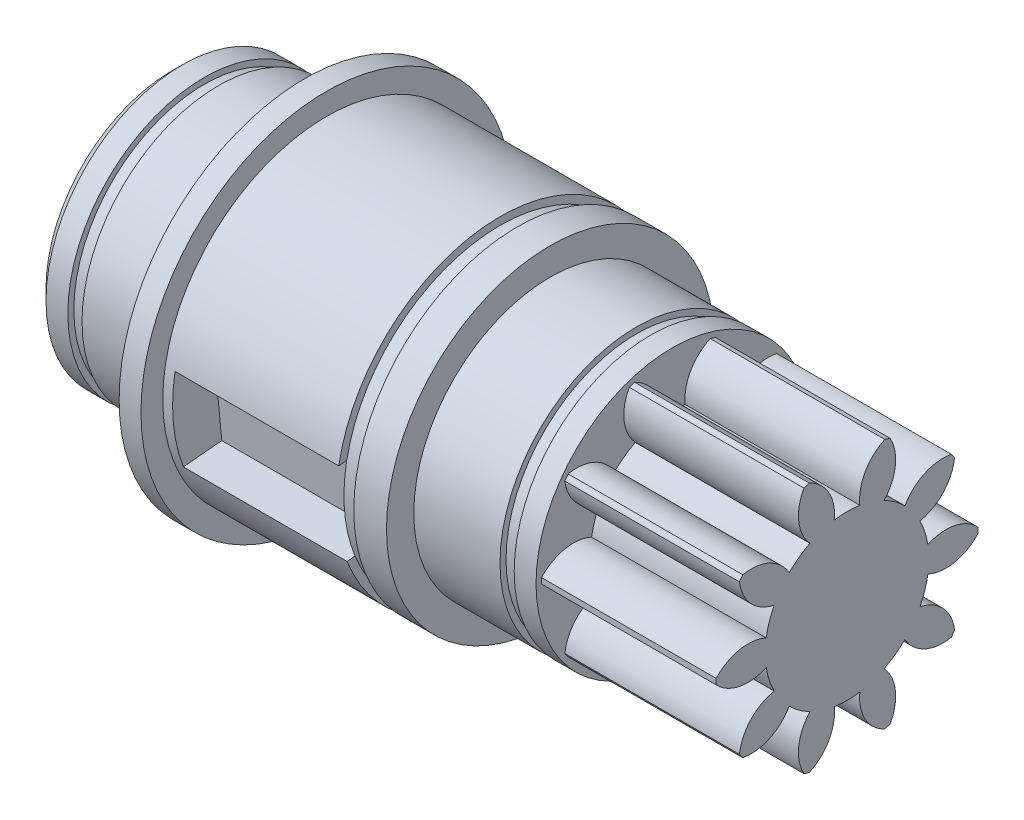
SolidWorks part; units mm, degrees
ref_plane "Plane1" through (0, 0, 0) normal (0, 0, 1) x (1, 0, 0)
ref_plane "Plane2" through (0, 0, 0) normal (0, 1, 0) x (1, 0, 0)
ref_plane "Plane3" through (0, 0, 0) normal (1, 0, 0) x (0, 0, -1)
sketch "HoldingSke" plane through (0, 0, 0) normal (0, 1, 0) x (1, 0, 0)
  line L0 (0, 0) -> (0.4924, -0.0868)
  line L1 (-15, 0) -> (100, 0) construction
  line L2 (0, 0) -> (-2.1039, 2.3779)
  line L3 (0, 0) -> (-11.863, 4.5341)
  line L4 (0, 0) -> (8.5048, 1.4996)
  line L5 (0, 0) -> (-46.8476, -17.4728)
  line L6 (0, 0) -> (-13.2634, -8.9489)
  line L7 (-2.1039, 2.3779) -> (8.6586, 51.2059)
  line L8 (-76.2, 54.61) -> (-73.9, 54.61)
  line L9 (-71.009, 38.7566) -> (-53.1078, 45.2721)
  line L10 (-76.2, 71.12) -> (104.1128, 71.12)
  line L11 (0, 0) -> (-16, 0)
  line L12 (-76.2, 101.6) -> (-76.133, 101.6)
  line L13 (24.9733, 27.94) -> (52.9518, 28.4284)
  line L14 (24.9733, 27.94) -> (24.9743, 27.94)
  line L15 (24.9733, 27.94) -> (100.4006, 29.5858)
  line L16 (-63.627, -2) -> (-12.827, -2)
  circle A0 centre (0, 0) radius 8
  circle A1 centre (0, 0) radius 7.499
  circle A2 centre (0, 0) radius 37.5
  circle A3 centre (0, 0) radius 7.4736
  dimension "MHD" = 14.998
  dimension "Hub_dia" = 75
  dimension "Bore" = 16
  dimension "MBD" = 14.9472
  dimension "Num_teeth" = 10
  dimension "Pitch_radius" = 180.3128
  dimension "Pitch" = 0.5
  dimension "Width" = 16
  dimension "Overall_len" = 50
  dimension "Show_teeth" = 10
  dimension "Thickness" = 16
  dimension "OAL" = 50.0001
  dimension "T_dim" = 2.3
  dimension "Ap" = 20
  dimension "H" = 19.05
  dimension "Backlash" = 0.067
  dimension "Addendum_fac" = 1
  dimension "Dedendum_fac" = 1.25
  dimension "Clearance_fac" = 0.25
  dimension "Dedendum_add" = 0.001
  dimension "Module" = 2
sketch "BasProSke" plane through (0, 0, 0) normal (0, 1, 0) x (1, 0, 0)
  line L0 (-10, 0) -> (60, 0) construction
  line L1 (0, 0) -> (0, 12)
  line L2 (0, 0) -> (16, 0)
  line L3 (16, 0) -> (16, 12)
  line L4 (16, 12) -> (0, 12)
  dimension "Diameter" = 24
  dimension "Thickness" = 16
revolve "Base-Revolve" add sketch "BasProSke" angle 360 about L0
sketch "TooCutSke" plane through (0, 0, 0) normal (1, 0, 0) x (0, 0, -1)
  line L1 (0, 0) -> (0, 107) construction
  line L2 (0, 0) -> (-1.6814, 9.8576) construction
  line L3 (0, 0) -> (-6.1153, 18.8209) construction
  line L4 (-1.6814, 9.8576) -> (-3.0576, 9.4105) construction
  arc A0 (1.1737, 7.4066) -> (-1.1737, 7.4066) centre (0, 0) ccw
  arc A1 (3.4979, 11.5054) -> (-3.4979, 11.5054) centre (0, 0) ccw
  circle A2 centre (0, 0) radius 10 construction
  circle A3 centre (0, 0) radius 9.3969 construction
  arc A4 (-1.1737, 7.4066) -> (-3.4979, 11.5054) centre (-5.1477, 7.8615) ccw
  arc A5 (3.4979, 11.5054) -> (1.1737, 7.4066) centre (5.1477, 7.8615) ccw
  dimension "Root_dia" = 14.998
  dimension "Overcut_dia" = 24.0508
  dimension "Pitch_dia" = 20
  dimension "Base_dia" = 18.7939
  dimension "Flank_rad" = 4
  dimension "Half_ang" = 18
  dimension "Half_CT" = 1.4471
extrude "ToothCut" cut sketch "TooCutSke" along normal through all
fillet "Breaks" [suppressed] radius 0.04
fillet "RootFillets" [suppressed] radius 0.501
pattern_circular "TeethCuts" count 10 every 36 about axis through (-10, 0, 0) along (1, 0, 0) of "ToothCut", "RootFillets", "Breaks"
sketch "HubNeaOneSke" plane through (0, 0, 0) normal (-1, 0, 0) x (0, 0, 1)
  circle A0 centre (0, 0) radius 7.499
  dimension "Diameter" = 14.998
extrude "HubNearOne" [suppressed] add sketch "HubNeaOneSke" along normal blind 34.0001
sketch "HubNeaBotSke" plane through (0, 0, 0) normal (-1, 0, 0) x (0, 0, 1)
  circle A0 centre (0, 0) radius 7.499
  dimension "Diameter" = 14.998
extrude "HubNearBoth" [suppressed] add sketch "HubNeaBotSke" along normal blind 17
ref_plane "FarPln" through (16, 0, 0) normal (1, 0, 0) x (0, 0, -1)
sketch "HubFarSke" plane through (16, 0, 0) normal (1, 0, 0) x (0, 0, -1)
  circle A0 centre (0, 0) radius 7.499
  dimension "Diameter" = 14.998
extrude "HubFar" [suppressed] add sketch "HubFarSke" along normal blind 17
sketch "BorSke" plane through (0, 0, 0) normal (1, 0, 0) x (0, 0, -1)
  circle A0 centre (0, 0) radius 7.4736
  dimension "Diameter" = 14.9472
extrude "Bore" cut sketch "BorSke" along normal mid plane 100.0001
sketch "KeySke" plane through (0, 0, 0) normal (1, 0, 0) x (0, 0, -1)
  line L0 (-2.5, 0) -> (-2.5, 9.7736)
  line L1 (-2.5, 9.7736) -> (2.5, 9.7736)
  line L2 (2.5, 9.7736) -> (2.5, 0)
  line L3 (0, 0) -> (0, 34) construction
  line L4 (-2.5, 0) -> (2.5, 0)
  dimension "Offset" = 9.7736
  dimension "Width" = 5
extrude "Keyway" [suppressed] cut sketch "KeySke" along normal mid plane 100.0001
pattern_circular "Keyway2" [suppressed] count 2 every 90 about axis through (-10, 0, 0) along (1, 0, 0)
sketch "Esquisse1" plane through (16, 0, 0) normal (1, 0, 0) x (0, 0, -1)
  circle A0 centre (0, 0) radius 7.499
  arc A1 (3.404, -6.6819) -> (5.303, -5.3022) centre (0, 0) ccw construction
extrude "Extrusion2" add sketch "Esquisse1" against normal blind 16
sketch "Esquisse2" plane through (0, 0, 0) normal (-1, 0, 0) x (0, 0, 1)
  circle A0 centre (0, 0) radius 12.5
  dimension "D1" = 25
extrude "Extrusion3" add sketch "Esquisse2" along normal blind 2
sketch "Esquisse3" plane through (-2, 0, 0) normal (-1, 0, 0) x (0, 0, 1)
  circle A0 centre (0, 0) radius 11.95
  dimension "D1" = 23.9
extrude "Extrusion4" add sketch "Esquisse3" along normal blind 1.3
sketch "Esquisse4" plane through (-3.3, 0, 0) normal (-1, 0, 0) x (0, 0, 1)
  circle A0 centre (0, 0) radius 12.5
  dimension "D1" = 25
extrude "Extrusion5" add sketch "Esquisse4" along normal blind 7.9
sketch "Esquisse5" plane through (-11.2, 0, 0) normal (-1, 0, 0) x (0, 0, 1)
  circle A0 centre (0, 0) radius 15
  dimension "D1" = 30
extrude "Extrusion6" add sketch "Esquisse5" along normal blind 3
sketch "Esquisse6" plane through (-14.2, 0, 0) normal (-1, 0, 0) x (0, 0, 1)
  circle A0 centre (0, 0) radius 14.3
  dimension "D1" = 28.6
extrude "Extrusion7" add sketch "Esquisse6" along normal blind 1.6
sketch "Esquisse7" plane through (-15.8, 0, 0) normal (-1, 0, 0) x (0, 0, 1)
  circle A0 centre (0, 0) radius 15
  dimension "D1" = 30
extrude "Extrusion8" add sketch "Esquisse7" along normal blind 15.9
sketch "Esquisse8" plane through (-31.7, 0, 0) normal (-1, 0, 0) x (0, 0, 1)
  circle A0 centre (0, 0) radius 17
  dimension "D1" = 34
extrude "Extrusion9" add sketch "Esquisse8" along normal blind 2
sketch "Esquisse9" plane through (-33.7, 0, 0) normal (-1, 0, 0) x (0, 0, 1)
  circle A0 centre (0, 0) radius 12.5
  dimension "D1" = 25
extrude "Extrusion11" add sketch "Esquisse9" along normal blind 7.9
sketch "Esquisse10" plane through (-41.6, 0, 0) normal (-1, 0, 0) x (0, 0, 1)
  circle A0 centre (0, 0) radius 11.95
  dimension "D1" = 23.9
extrude "Extrusion12" add sketch "Esquisse10" along normal blind 1.3
sketch "Esquisse11" plane through (-42.9, 0, 0) normal (-1, 0, 0) x (0, 0, 1)
  circle A0 centre (0, 0) radius 12.5
  dimension "D1" = 25
extrude "Extrusion13" add sketch "Esquisse11" along normal blind 3
chamfer "Chanfrein1" distance 1 angle 45 1 edges at (-45.9, 0, 12.5)
sketch "Esquisse12" plane through (-15.8, 0, 0) normal (1, 0, 0) x (0, 0, -1)
  line L0 (-18.2565, 2.2687) -> (-17.4933, -5.6948)
  line L1 (-17.4933, -5.6948) -> (-10.4933, -5.0239)
  line L2 (-10.4933, -5.0239) -> (-11.2565, 2.9396)
  line L3 (-11.2565, 2.9396) -> (-18.2565, 2.2687)
  dimension "D1" = 7
extrude "Enlèv. mat.-Extru.1" cut sketch "Esquisse12" against normal blind 15
equation "' \"Module@HoldingSke\" = 6.35"
equation "' \"Num_teeth@HoldingSke\" = 12"
equation "' \"Ap@HoldingSke\" =  20"
equation "' \"Width@HoldingSke\" = 0.5 * 25.4"
equation "' \"Hub_dia@HoldingSke\"= 1 * 25.4"
equation "' \"Overall_len@HoldingSke\" = 1.0 * 25.4"
equation "' \"Bore@HoldingSke\" = 0.75 * 25.4"
equation "' \"T_dim@HoldingSke\" = 0.1 * 25.4"
equation "' \"Width@KeySke\" = 0.25 * 25.4"
equation "' \"Show_teeth@HoldingSke\" = 13"
equation "' \"Backlash@HoldingSke\" = 0.009 * 25.4"
equation "' \"Addendum_fac@HoldingSke\" = 1.0"
equation "' \"Dedendum_fac@HoldingSke\" = 1.25"
equation "' \"Dedendum_add@HoldingSke\" = 0.00005 * 25.4"
equation "' \"Clearance_fac@HoldingSke\" = 0.25"
equation "\"Pitch@HoldingSke\" = 1 / \"Module@HoldingSke\""
equation "\"Overcut_dia@TooCutSke\" = (\"Num_teeth@HoldingSke\" + 2 * \"Addendum_fac@HoldingSke\") / \"Pitch@HoldingSke\" + 0.002 * 25.4"
equation "\"Pitch_dia@TooCutSke\" = \"Num_teeth@HoldingSke\" / \"Pitch@HoldingSke\""
equation "\"Base_dia@TooCutSke\" = \"Num_teeth@HoldingSke\" / \"Pitch@HoldingSke\" * cos((\"Ap@HoldingSke\"  * 3.14159265 / 180))"
equation "\"Root_dia@TooCutSke\" = (\"Num_teeth@HoldingSke\" + 2) / \"Pitch@HoldingSke\" - 2 * (\"Addendum_fac@HoldingSke\" + \"Dedendum_fac@HoldingSke\") / \"Pitch@HoldingSke\" - \"Dedendum_add@HoldingSke\" * 2"
equation "\"Half_ang@TooCutSke\" = 180 / \"Num_teeth@HoldingSke\""
equation "\"Half_CT@TooCutSke\" = \"Num_teeth@HoldingSke\" / \"Pitch@HoldingSke\" * sin((3.14159265 / 2 / \"Num_teeth@HoldingSke\")) / 2 - 7 * \"Backlash@HoldingSke\" / 4"
equation "\"Flank_rad@TooCutSke\" = \"Num_teeth@HoldingSke\" / \"Pitch@HoldingSke\" / 5"
equation "\"Radius@RootFillets\" = \"Clearance_fac@HoldingSke\" / \"Pitch@HoldingSke\" + \"Dedendum_add@HoldingSke\""
equation "\"Break_rad@Breaks\" = 0.02 / \"Pitch@HoldingSke\""
equation "\"Thickness@HoldingSke\" = \"Width@HoldingSke\""
equation "\"OAL@HoldingSke\" = \"Thickness@HoldingSke\""
equation "\"MHD@HoldingSke\" = (\"Num_teeth@HoldingSke\" + 2) / \"Pitch@HoldingSke\" - 2 * (\"Addendum_fac@HoldingSke\" + \"Dedendum_fac@HoldingSke\")  / \"Pitch@HoldingSke\" - \"Dedendum_add@HoldingSke\" * 2"
equation "\"MBD@HoldingSke\" = (\"Num_teeth@HoldingSke\" + 2) / \"Pitch@HoldingSke\" - 2 * (\"Addendum_fac@HoldingSke\" + \"Dedendum_fac@HoldingSke\")  / \"Pitch@HoldingSke\" - \"Dedendum_add@HoldingSke\" * 2 - 0.002 * 25.4"
equation "\"MHD@HoldingSke\" = ((sgn( \"MHD@HoldingSke\" - \"Hub_dia@HoldingSke\" )-1)*( \"MHD@HoldingSke\" - \"Hub_dia@HoldingSke\" ))/-2+ \"Hub_dia@HoldingSke\""
equation "\"MBD@HoldingSke\" = ((sgn( \"MBD@HoldingSke\" - \"Bore@HoldingSke\" )-1)*( \"MBD@HoldingSke\" - \"Bore@HoldingSke\" ))/-2+ \"Bore@HoldingSke\""
equation "\"OAL@HoldingSke\" = ((sgn( \"OAL@HoldingSke\" - \"Overall_len@HoldingSke\" )+1)*( \"OAL@HoldingSke\" - \"Overall_len@HoldingSke\" ))/2 + \"Overall_len@HoldingSke\" + 0.000002 * 25.4"
equation "\"Num_teeth@TeethCuts\" = int( \"Show_teeth@HoldingSke\" ) + 1"
equation "\"Num_teeth@TeethCuts\" = ((sgn( \"Num_teeth@TeethCuts\" - \"Num_teeth@HoldingSke\" )-1)*( \"Num_teeth@TeethCuts\" - \"Num_teeth@HoldingSke\" ))/-2+ \"Num_teeth@HoldingSke\""
equation "\"Num_teeth@TeethCuts\" = ((sgn( \"Num_teeth@TeethCuts\" - 2.0)+1)*( \"Num_teeth@TeethCuts\" - 2.0))/2 +2.0"
equation "\"Angle@TeethCuts\" = 360.0 / \"Num_teeth@HoldingSke\""
equation "\"Diameter@BasProSke\" = (\"Num_teeth@HoldingSke\" + 2 * \"Addendum_fac@HoldingSke\") / \"Pitch@HoldingSke\""
equation "\"Thickness@BasProSke\"  = \"Thickness@HoldingSke\""
equation "' \"Fillet_rad@BasProSke\" =  \"Thickness@HoldingSke\" * 0.05"
equation "\"MHD@HoldingSke\" = ((sgn( \"MHD@HoldingSke\" - \"Root_dia@TooCutSke\" )-1)*( \"MHD@HoldingSke\" - \"Root_dia@TooCutSke\" ))/-2+ \"Root_dia@TooCutSke\""
equation "\"Diameter@HubNeaOneSke\" = \"MHD@HoldingSke\""
equation "\"Length@HubNearOne\" = \"OAL@HoldingSke\" - \"Thickness@BasProSke\""
equation "\"Diameter@HubNeaBotSke\" = \"MHD@HoldingSke\""
equation "\"Length@HubNearBoth\" = ( \"OAL@HoldingSke\" - \"Thickness@BasProSke\" ) / 2.0"
equation "\"Thickness@FarPln\" = \"Thickness@BasProSke\""
equation "\"Diameter@HubFarSke\" = \"MHD@HoldingSke\""
equation "\"Length@HubFar\" = ( \"OAL@HoldingSke\" - \"Thickness@BasProSke\" ) / 2.0"
equation "\"Diameter@BorSke\" = \"MBD@HoldingSke\""
equation "\"D1@Bore\" = \"OAL@HoldingSke\" * 2.0"
equation "\"D1@Keyway\" = \"OAL@HoldingSke\" * 2.0"
equation "\"Offset@KeySke\" = \"T_dim@HoldingSke\" + \"MBD@HoldingSke\" / 2.0"
